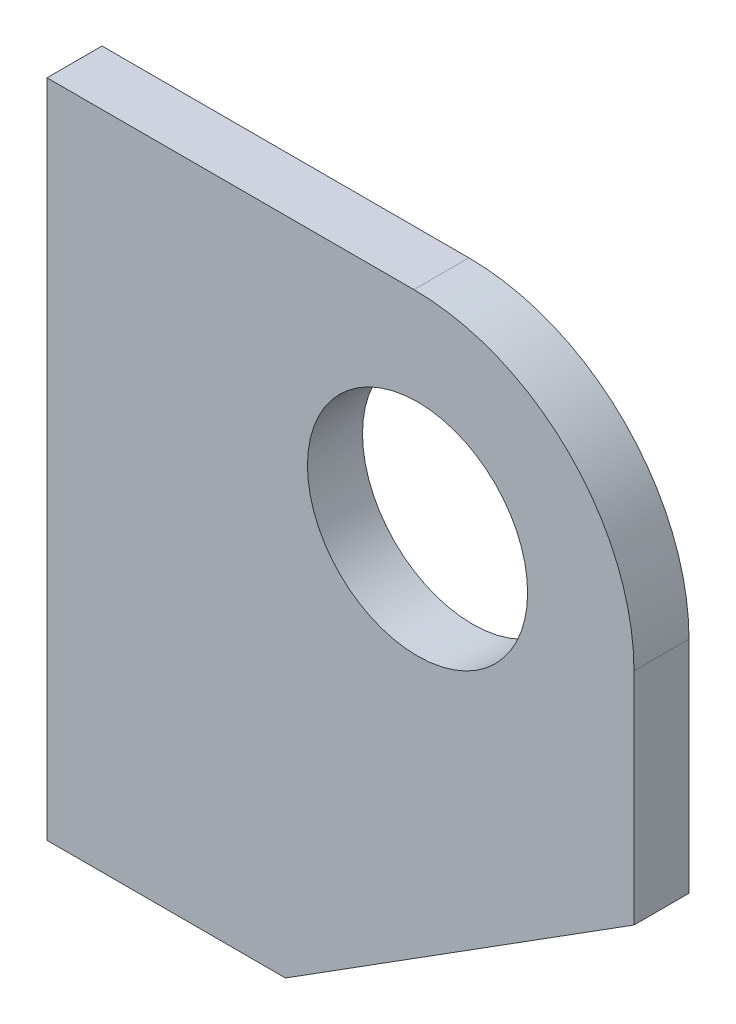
SolidWorks part; units mm, degrees
ref_plane "Front Plane" through (0, 0, 0) normal (0, 0, 1) x (1, 0, 0)
ref_plane "Top Plane" through (0, 0, 0) normal (0, 1, 0) x (1, 0, 0)
ref_plane "Right Plane" through (0, 0, 0) normal (1, 0, 0) x (0, 0, -1)
sketch "Sketch1" plane through (0, 0, 0) normal (0, 0, 1) x (1, 0, 0)
  line L0 (0, 0) -> (0, 180)
  line L1 (0, 180) -> (160, 180)
  line L2 (0, 0) -> (65, 0)
  line L4 (160, 180) -> (160, 60)
  line L6 (160, 60) -> (65, 0)
  circle A1 centre (101, 124) radius 30
  dimension "D1" = 180
  dimension "D5" = 60
  dimension "D2" = 160
  dimension "D3" = 65
  dimension "D4" = 60
  dimension "D6" = 101
  dimension "D7" = 124
extrude "Boss-Extrude1" add sketch "Sketch1" along normal blind 15
fillet "Fillet1" radius 60 1 edges at (160, 180, 7.5)
